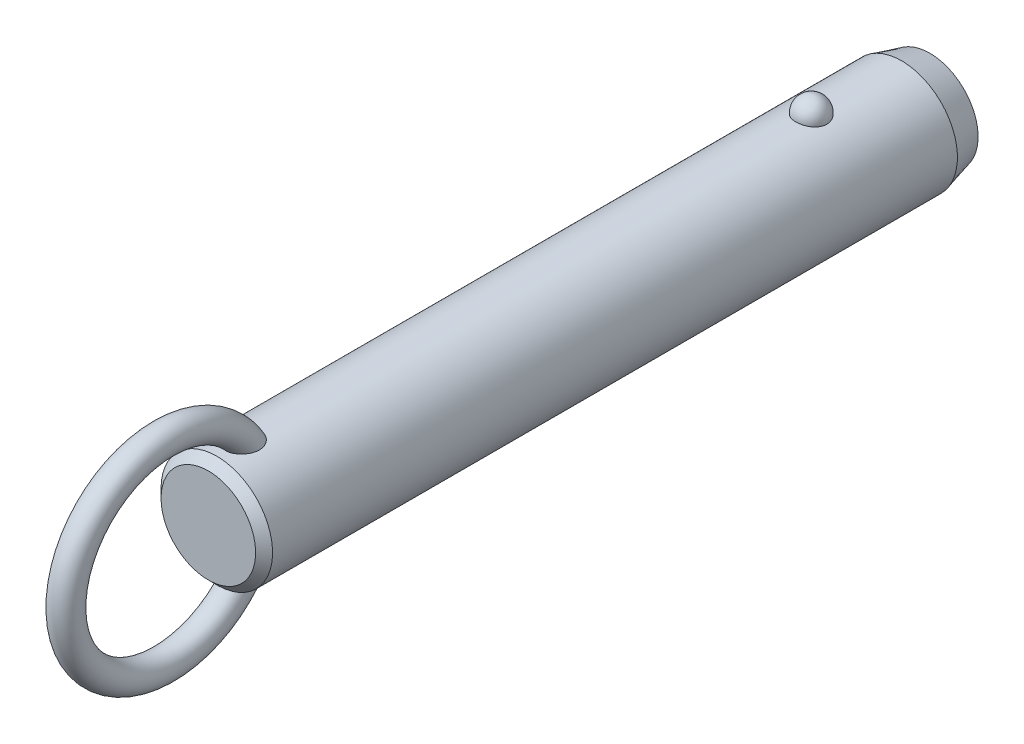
SolidWorks part; units mm, degrees
ref_plane "Front Plane" through (0, 0, 0) normal (0, 0, 1) x (1, 0, 0)
ref_plane "Top Plane" through (0, 0, 0) normal (0, 1, 0) x (1, 0, 0)
ref_plane "Right Plane" through (0, 0, 0) normal (1, 0, 0) x (0, 0, -1)
sketch "Sketch2" plane through (0, 0, 0) normal (0, 0, 1) x (1, 0, 0)
  circle A0 centre (0, 0) radius 7.9
  point P3 (0, 7.9)
  dimension "D1" = 15.8
extrude "Boss-Extrude1" add sketch "Sketch2" along normal blind 73.7
sketch "Sketch3" plane through (0, 0, 0) normal (0, 0, -1) x (-1, 0, 0)
  circle A0 centre (0, 0) radius 7.9
  dimension "D1" = 15.8
extrude "Boss-Extrude2" add sketch "Sketch3" along normal blind 19
chamfer "Chamfer1" distance 4 angle 15 1 edges at (-7.9, 0, -19)
sketch "Sketch12" plane through (0, 0, 0) normal (1, 0, 0) x (0, 0, -1)
  line L0 (-73.7, 7.9) -> (-73.7, -7.9) construction
  point P0 (-73.7, 0)
sketch "Sketch13" plane through (0, 0, 0) normal (1, 0, 0) x (0, 0, -1)
  circle A0 centre (-89.55, 0) radius 15.85
  point P2 (-73.7, 0)
  dimension "D1" = 31.7
sketch "Sketch14" plane through (0, 0, 0) normal (0, 1, 0) x (1, 0, 0)
  circle A0 centre (0, -75.7) radius 2
  point P2 (0, -73.7)
  dimension "D1" = 4
sweep "Sweep1" add profiles "Sketch14" path "Sketch13"
sketch "Sketch15" plane through (0, 0, 73.7) normal (0, 0, 1) x (1, 0, 0)
  circle A0 centre (0, 0) radius 7.9
  dimension "D1" = 15.8
extrude "Boss-Extrude3" add sketch "Sketch15" along normal blind 9.52
chamfer "Chamfer2" distance 1.2 angle 45 1 edges at (7.9, 0, 83.22)
sketch "Sketch18" plane through (0, 0, 0) normal (1, 0, 0) x (0, 0, -1)
  line L0 (15, 7.9) -> (-75.8091, 7.9) construction
  line L1 (2.2, 10.1) -> (2.2, 5.7)
  line L2 (-75.8091, -7.9) -> (15, -7.9) construction
  arc A0 (2.2, 10.1) -> (2.2, 5.7) centre (2.2, 7.9) ccw
  point P4 (0, 7.9)
  dimension "D1" = 18
revolve "Revolve1" add sketch "Sketch18" angle 360 about L1
